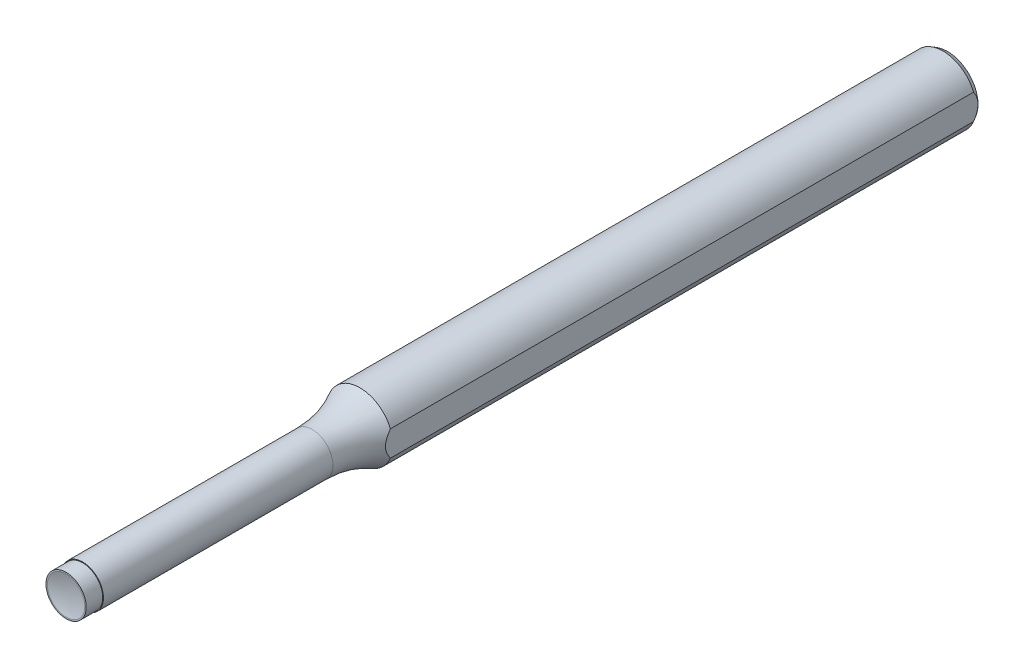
SolidWorks part; units mm, degrees
ref_plane "Front Plane" through (0, 0, 0) normal (0, 0, 1) x (1, 0, 0)
ref_plane "Top Plane" through (0, 0, 0) normal (0, 1, 0) x (1, 0, 0)
ref_plane "Right Plane" through (0, 0, 0) normal (1, 0, 0) x (0, 0, -1)
sketch "Sketch1" plane through (0, 0, 0) normal (0, 0, 1) x (1, 0, 0)
  circle A0 centre (0, 0) radius 4.765
  dimension "D1" = 9.53
extrude "Boss-Extrude1" add sketch "Sketch1" against normal blind 127
sketch "Sketch2" plane through (0, 0, 0) normal (0, 0, 1) x (1, 0, 0)
  circle A0 centre (0, 0) radius 3
  dimension "D1" = 6
extrude "Cut-Extrude1" cut sketch "Sketch2" against normal blind 42.3333 flip side to cut
sketch "Sketch3" plane through (0, 0, 0) normal (0, 0, 1) x (1, 0, 0)
  circle A0 centre (0, 0) radius 2.9
  dimension "D1" = 5.8
extrude "Cut-Extrude2" cut sketch "Sketch3" against normal blind 2.3825 flip side to cut
sketch "Sketch4" plane through (0, 0, 0) normal (1, 0, 0) x (0, 0, -1)
  line L0 (0, 0) -> (0, 2.7)
  line L1 (0, 2.9) -> (0, -2.9) construction
  line L2 (0.3905, 0) -> (0.3905, 2.7) construction
  line L3 (0, 0) -> (0.3905, 0)
  line L4 (0, 0) -> (0, -2.7) construction
  arc A0 (0.3905, 0) -> (0, 2.7) centre (-9.1395, 0) ccw
  dimension "D2" = 9.53
  dimension "D1" = 5.4
revolve "Cut-Revolve1" cut sketch "Sketch4" angle 360 about L3
chamfer "Chamfer1" distance 0.6353 angle 30 1 edges at (4.765, 0, -127)
sketch "Sketch5" plane through (0, 0, 0) normal (1, 0, 0) x (0, 0, -1)
  line L0 (42.3333, 0) -> (35.4525, 0)
  line L1 (42.3333, 4.765) -> (42.3333, -4.765) construction
  line L2 (35.4525, 0) -> (35.4525, 3)
  line L3 (42.3333, 3) -> (2.3825, 3) construction
  line L4 (42.3333, 4.765) -> (42.3333, 0)
  line L5 (35.4525, 3) -> (42.3333, 3) construction
  arc A0 (35.4525, 3) -> (42.3333, 4.765) centre (35.4525, 17.295) ccw
  dimension "D1" = 14.295
revolve "Revolve1" add sketch "Sketch5" angle 360 about L0
sketch "Sketch6" plane through (0, 0, 0) normal (1, 0, 0) x (0, 0, -1)
  line L0 (84.6667, 0) -> (98.9617, 0)
  line L1 (84.6667, 0) -> (84.6667, 9.53)
  line L2 (84.6667, 9.53) -> (90.7084, 9.53)
  line L3 (98.9617, 0) -> (98.9617, 4.765)
  line L4 (126.3647, 4.765) -> (42.3333, 4.765) construction
  line L5 (98.9617, 4.765) -> (84.6667, 4.765) construction
  line L6 (127, -4.765) -> (127, 4.765) construction
  arc A0 (98.9617, 4.765) -> (90.7084, 9.53) centre (98.9617, 14.295) cw
  dimension "D2" = 9.53
  dimension "D1" = 42.3333
  dimension "D3" = 14.295
revolve "Revolve2" [suppressed] add sketch "Sketch6" angle 360 about L0
sketch "Sketch7" plane through (0, 0, -127) normal (0, 0, -1) x (-1, 0, 0)
  line L9 (-8.0649, 1.8333) -> (-4.3982, 1.8333)
  line L10 (-8.0649, 1.8333) -> (-8.0649, -1.8333)
  line L11 (-8.0649, -1.8333) -> (-4.3982, -1.8333)
  line L12 (-4.3982, 1.8333) -> (-4.3982, -1.8333)
  circle A5 centre (0, 0) radius 4.765 construction
  circle A6 centre (0, 0) radius 4.3982 construction
  point P8 (-4.3982, 0)
extrude "Cut-Extrude3" cut sketch "Sketch7" against normal through all
